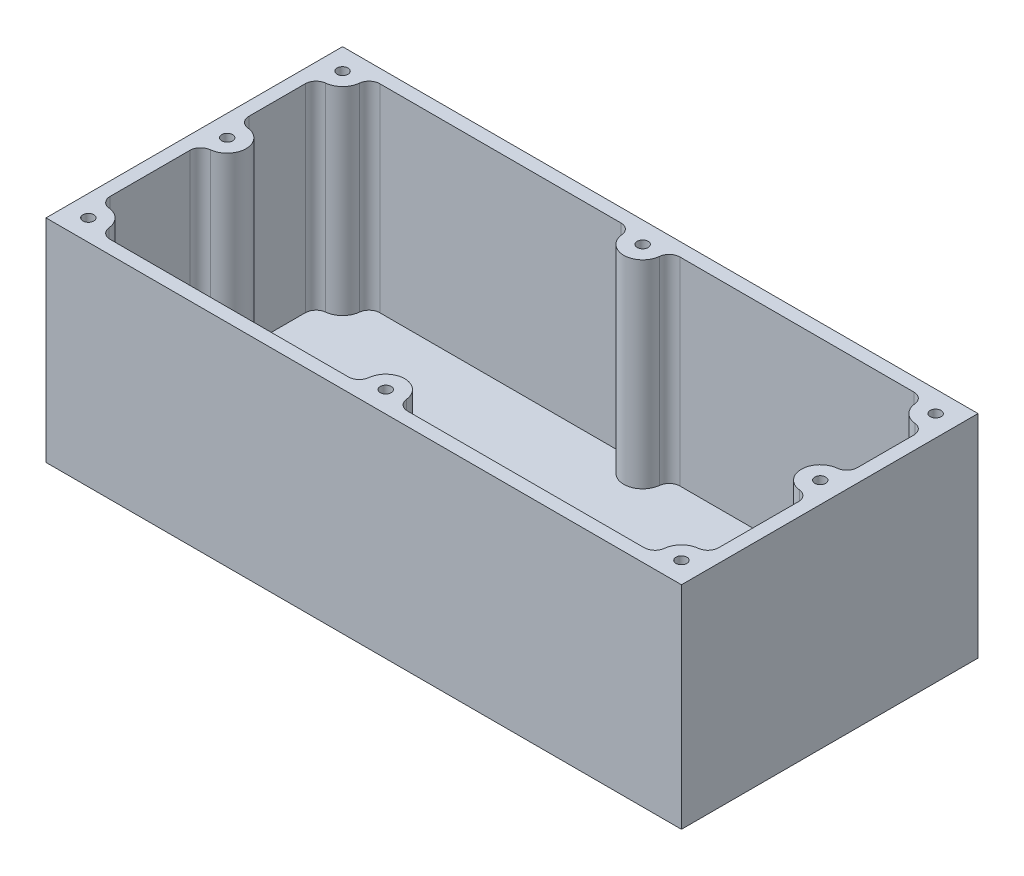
SolidWorks part; units mm, degrees
ref_plane "Front Plane" through (0, 0, 0) normal (0, 0, 1) x (1, 0, 0)
ref_plane "Top Plane" through (0, 0, 0) normal (0, 1, 0) x (1, 0, 0)
ref_plane "Right Plane" through (0, 0, 0) normal (1, 0, 0) x (0, 0, -1)
sketch "Sketch1" plane through (0, 0, 0) normal (0, 1, 0) x (1, 0, 0)
  line L1 (-75, -35) -> (75, -35)
  line L2 (-75, -35) -> (-75, 35)
  line L3 (-75, 35) -> (75, 35)
  line L4 (75, -35) -> (75, 35)
  line L5 (-75, -35) -> (75, 35) construction
  line L6 (-75, 35) -> (75, -35) construction
  point P0 (0, 0)
  point P5 (0, 0)
  dimension "D1" = 150
  dimension "D2" = 70
extrude "Boss-Extrude1" add sketch "Sketch1" along normal blind 50 contours L1 L4 L3 L2
sketch "Sketch4" plane through (0, 50, 0) normal (0, 1, 0) x (1, 0, 0)
  line L0 (75, -35) -> (75, 35) construction
  line L1 (-75, -35) -> (75, -35) construction
  line L2 (-75, 35) -> (75, 35) construction
  line L4 (-75, -35) -> (-75, 35) construction
  point P0 (70, -30)
  point P1 (0, 0)
  point P2 (70, 30)
  point P3 (0.8468, 30)
  point P4 (-70, 30)
  point P5 (-70, 2.7613)
  point P6 (-70, -30)
  point P7 (0.1981, -30)
  point P8 (-70.8468, 3.2792)
  point P9 (70, 2.7613)
  point P10 (69.8019, -31.4108)
  point P15 (0, 0)
  point P16 (0, 0)
  point P17 (0, 0)
  point P18 (0, 0)
  point P21 (0, 0)
  point P22 (0, 0)
  point P25 (0, 0)
  point P26 (0, 0)
  point P27 (0, 0)
hole_wizard "#5-40 Tapped Hole1" positions "Sketch6" profile "Sketch7" tap size "#5-40" standard "ANSI Inch"
sketch "Sketch6" plane through (0, 50, 0) normal (0, 1, 0) x (1, 0, 0)
  point P0 (70, 30)
  point P3 (70, 2.7613)
  point P6 (70, -30)
  point P9 (0.1981, -30)
  point P12 (0.8468, 30)
  point P15 (-70, 30)
  point P18 (-70, 2.7613)
  point P21 (-70, -30)
  point P24 (0.1981, -30)
sketch "Sketch7" plane through (70, 50, -30) normal (1, 0, 0) x (0, 0, 1)
  line L0 (0, 0) -> (0, 50)
  line L1 (0, 50) -> (1.289, 50)
  line L2 (1.289, 50) -> (1.289, 0)
  line L5 (1.289, 0) -> (0, 0)
  line L11 (0, -6.35) -> (0, 107.95) construction
  dimension "Thru Tap Drill Dia." = 2.5781
  dimension "Thru Tap Drill Depth" = 50
shell "Shell1" thickness 3.175
fillet "Fillet5" radius 2.54 16 edges at (-65.926, 26.5875, 31.825) (4.272, 26.5875, 31.825) (-3.8759, 26.5875, 31.825) (65.926, 26.5875, 31.825) (71.825, 26.5875, -6.8353) (71.825, 26.5875, 1.3126) (71.825, 26.5875, -25.926) (65.926, 26.5875, -31.825) (4.9208, 26.5875, -31.825) (-3.2272, 26.5875, -31.825) (-65.926, 26.5875, -31.825) (-71.825, 26.5875, -25.926) (-71.825, 26.5875, -6.8353) (-71.825, 26.5875, 1.3126) (-71.825, 26.5875, 25.926) (71.825, 26.5875, 25.926)
equation "\"D2@Sketch4\"=\"D1@Sketch4\""
equation "\"D3@Sketch4\"=\"D1@Sketch4\""
equation "\"D4@Sketch4\"=\"D1@Sketch4\""
